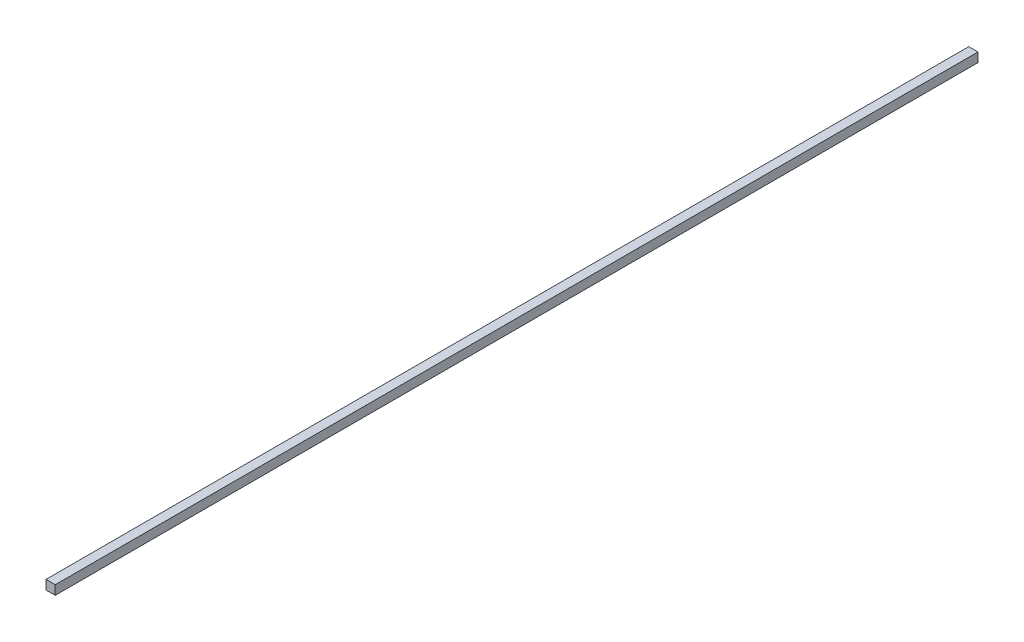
SolidWorks part; units mm, degrees
ref_plane "Plan de face" through (0, 0, 0) normal (0, 0, 1) x (1, 0, 0)
ref_plane "Plan de dessus" through (0, 0, 0) normal (0, 1, 0) x (1, 0, 0)
ref_plane "Plan de droite" through (0, 0, 0) normal (1, 0, 0) x (0, 0, -1)
sketch "Esquisse1" plane through (0, 0, 0) normal (0, 0, 1) x (1, 0, 0)
  line L1 (-1, 1) -> (1, 1)
  line L2 (-1, 1) -> (-1, -1)
  line L3 (-1, -1) -> (1, -1)
  line L4 (1, 1) -> (1, -1)
  point P4 (0, 1)
  point P5 (-1, 0)
  dimension "D1" = 2
  dimension "D2" = 2
extrude "Extrusion1" add sketch "Esquisse1" along normal mid plane 200
